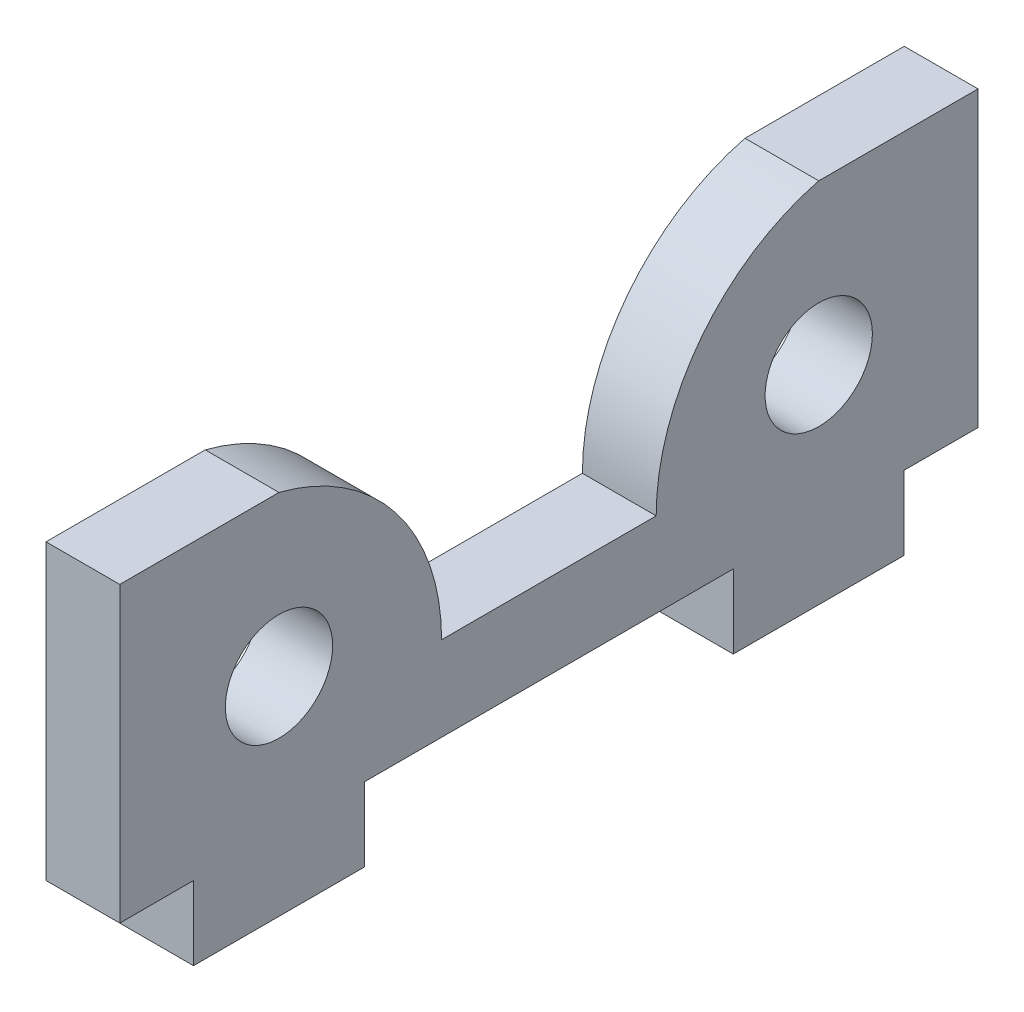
SolidWorks part; units mm, degrees
ref_plane "Front Plane" through (0, 0, 0) normal (0, 0, 1) x (1, 0, 0)
ref_plane "Top Plane" through (0, 0, 0) normal (0, 1, 0) x (1, 0, 0)
ref_plane "Right Plane" through (0, 0, 0) normal (1, 0, 0) x (0, 0, -1)
sketch "Sketch1" plane through (0, 0, 0) normal (1, 0, 0) x (0, 0, -1)
  line L0 (-53, 0) -> (-40.25, 0) construction
  line L1 (-53, 0) -> (-53, 5.5) construction
  line L2 (-53, 5.5) -> (0, 5.5) construction
  line L3 (0, 5.5) -> (0, 0) construction
  line L4 (-53, 5.5) -> (-40.25, 5.5) construction
  line L5 (-40.25, 5.5) -> (-40.25, 0) construction
  line L6 (0, 0) -> (-12.75, 0) construction
  line L7 (-12.75, 0) -> (-12.75, 5.5) construction
  line L8 (-53, 5.5) -> (-58.5, 5.5) construction
  line L9 (-58.5, 5.5) -> (-58.5, 27.375) construction
  line L10 (-58.5, 27.375) -> (5.5, 27.375) construction
  line L11 (5.5, 27.375) -> (5.5, 5.5) construction
  line L12 (5.5, 5.5) -> (0, 5.5) construction
  line L13 (-58.5, 5.5) -> (-58.5, 15.5) construction
  line L14 (-58.5, 15.5) -> (5.5, 15.5) construction
  line L15 (-6.375, 0) -> (-6.375, 15.5) construction
  line L16 (-46.625, 0) -> (-46.625, 15.5) construction
  line L17 (-46.625, 15.5) -> (-46.625, 27.375) construction
  line L18 (-6.375, 15.5) -> (-6.375, 27.375) construction
  line L19 (-58.5, 5.5) -> (-37.5417, 23.1491) construction
  line L20 (-18.5, 19.2) -> (-18.5, 11.8) construction
  line L21 (5.5, 5.5) -> (-15.4583, 23.1491) construction
  line L22 (-18.5, 11.8) -> (-34.5, 11.8) construction
  line L23 (-58.5, 5.5) -> (-53, 5.5)
  line L24 (-53, 5.5) -> (-53, 0)
  line L25 (-53, 0) -> (-40.25, 0)
  line L26 (-40.25, 0) -> (-40.25, 5.5)
  line L27 (-40.25, 5.5) -> (-12.75, 5.5)
  line L28 (-12.75, 5.5) -> (-12.75, 0)
  line L29 (-12.75, 0) -> (0, 0)
  line L30 (0, 0) -> (0, 5.5)
  line L31 (0, 5.5) -> (5.5, 5.5)
  line L32 (5.5, 5.5) -> (5.5, 27.375)
  line L33 (5.5, 27.375) -> (-6.375, 27.375)
  line L36 (-58.5, 5.5) -> (-58.5, 27.375)
  line L37 (-58.5, 27.375) -> (-46.625, 27.375)
  line L38 (-34.5, 15.5) -> (-18.5, 15.5) construction
  line L39 (-34.5, 11.8) -> (-34.5, 19.2) construction
  line L40 (-18.5, 11.8) -> (-34.5, 11.8)
  circle A0 centre (-46.625, 15.5) radius 4
  circle A1 centre (-6.375, 15.5) radius 4
  arc A3 (-12.7793, 5.5) -> (-12.75, 5.4813) centre (-6.375, 15.5) ccw
  arc A6 (0, 5.4813) -> (0.0293, 5.5) centre (-6.375, 15.5) ccw
  arc A9 (-34.5, 11.8) -> (-46.625, 27.375) centre (-50.5658, 11.8) ccw
  arc A10 (-18.5, 11.8) -> (-6.375, 27.375) centre (-2.4342, 11.8) cw
  point P32 (-26.5, 15.5)
  point P37 (-18.5, 15.5)
  dimension "D1" = 53
  dimension "D6" = 8
  dimension "D7" = 8
  dimension "D8" = 10
  dimension "D2" = 12.75
  dimension "D3" = 12.75
  dimension "D4" = 5.5
  dimension "D5" = 5.5
  dimension "D9" = 3.7
  dimension "D10" = 16
extrude "Boss-Extrude6" add sketch "Sketch1" along normal blind 5.5 contours A10 L40 A9 L37 L36 L23 L24 L25 L26 L27 L28 L29 L30 L31 L32 L33 A1 A0
